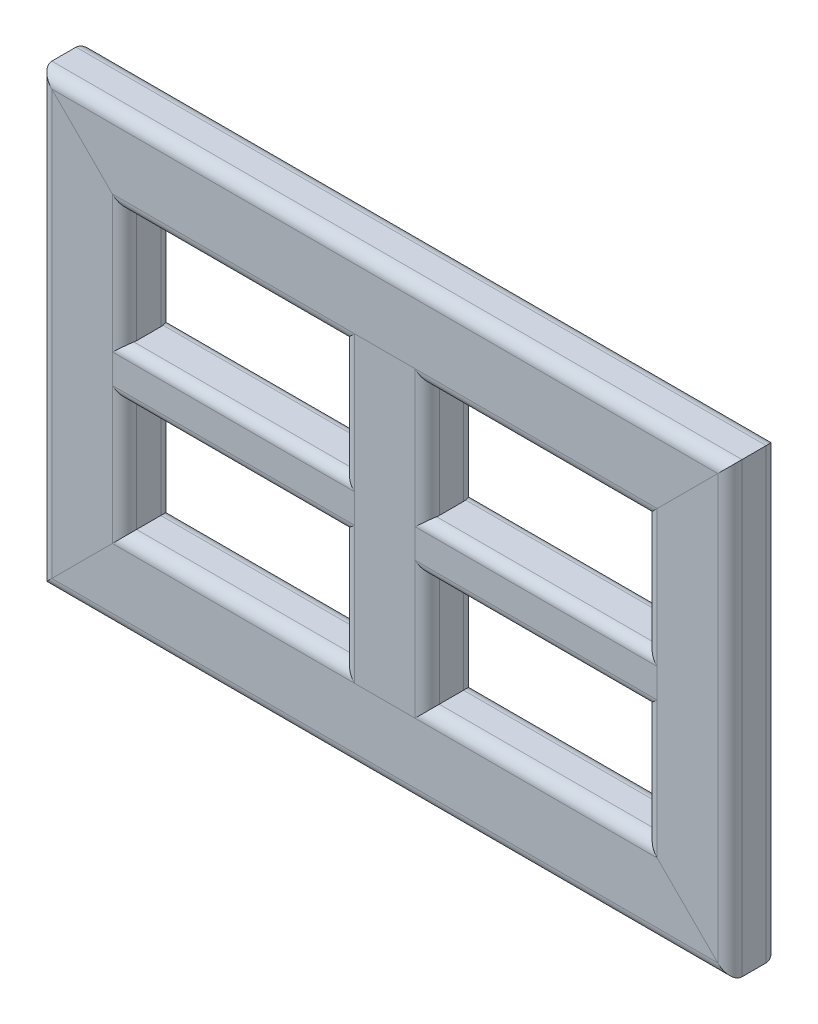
SolidWorks part; units mm, degrees
ref_plane "Płaszczyzna przednia" through (0, 0, 0) normal (0, 0, 1) x (1, 0, 0)
ref_plane "Płaszczyzna górna" through (0, 0, 0) normal (0, 1, 0) x (1, 0, 0)
ref_plane "Płaszczyzna prawa" through (0, 0, 0) normal (1, 0, 0) x (0, 0, -1)
sketch "Szkic1" plane through (0, 0, 0) normal (0, 0, 1) x (1, 0, 0)
  line L0 (0, 150) -> (0, -150)
  line L1 (250, -150) -> (-250, -150)
  line L2 (250, -150) -> (250, 150)
  line L3 (250, 150) -> (-250, 150)
  line L4 (-250, -150) -> (-250, 150)
  line L5 (250, -150) -> (-250, 150) construction
  line L6 (250, 150) -> (-250, -150) construction
  line L7 (-250, 0) -> (250, 0)
  point P0 (0, 0)
  dimension "D1" = 300
  dimension "D2" = 500
other "Rura prostokątna 70 X 40 X 5(1)"
ref_plane "Płaszczyzna1" through (-250, -150, 0) normal (0, 1, 0) x (0, 0, 1)
sketch "Sketch1" plane through (-250, -150, 0) normal (0, 1, 0) x (0, 0, 1)
  line L0 (-10, -30) -> (10, -30)
  line L1 (-15, -25) -> (-15, 25)
  line L2 (10, 30) -> (-10, 30)
  line L3 (15, 25) -> (15, -25)
  line L4 (-10, -35) -> (10, -35)
  line L5 (-20, -25) -> (-20, 25)
  line L6 (10, 35) -> (-10, 35)
  line L7 (20, 25) -> (20, -25)
  arc A0 (20, 25) -> (10, 35) centre (10, 25) ccw
  arc A1 (10, -35) -> (20, -25) centre (10, -25) ccw
  arc A2 (-20, -25) -> (-10, -35) centre (-10, -25) ccw
  arc A3 (-10, 35) -> (-20, 25) centre (-10, 25) ccw
  arc A4 (-10, 30) -> (-15, 25) centre (-10, 25) ccw
  arc A5 (15, 25) -> (10, 30) centre (10, 25) ccw
  arc A6 (10, -30) -> (15, -25) centre (10, -25) ccw
  arc A7 (-15, -25) -> (-10, -30) centre (-10, -25) ccw
  point P0 (0, 35)
  point P1 (20, 0)
  point P2 (0, -35)
  point P3 (-20, 0)
  point P4 (-20, 35)
  point P5 (20, 35)
  point P6 (20, -35)
  point P7 (-20, -35)
  point P8 (0, 0)
  point P33 (0, 0)
  dimension "D1" = 10
  dimension "Thickness" = 5
  dimension "V_leg" = 70
  dimension "H_leg" = 40
other "Rura kwadratowa 40 X 40 X 4(1)"
ref_plane "Płaszczyzna2" through (-250, 0, 0) normal (1, 0, 0) x (0, 1, 0)
sketch "Sketch11" plane through (-250, 0, 0) normal (1, 0, 0) x (0, 1, 0)
  line L0 (-12, -16) -> (12, -16)
  line L1 (-16, -12) -> (-16, 12)
  line L2 (12, 16) -> (-12, 16)
  line L3 (16, 12) -> (16, -12)
  line L4 (-12, -20) -> (12, -20)
  line L5 (-20, -12) -> (-20, 12)
  line L6 (12, 20) -> (-12, 20)
  line L7 (20, 12) -> (20, -12)
  arc A0 (20, 12) -> (12, 20) centre (12, 12) ccw
  arc A1 (12, -20) -> (20, -12) centre (12, -12) ccw
  arc A2 (-20, -12) -> (-12, -20) centre (-12, -12) ccw
  arc A3 (-12, 20) -> (-20, 12) centre (-12, 12) ccw
  arc A4 (-12, 16) -> (-16, 12) centre (-12, 12) ccw
  arc A5 (16, 12) -> (12, 16) centre (12, 12) ccw
  arc A6 (12, -16) -> (16, -12) centre (12, -12) ccw
  arc A7 (-16, -12) -> (-12, -16) centre (-12, -12) ccw
  point P0 (-20, 0)
  point P1 (20, 0)
  point P2 (0, 20)
  point P3 (0, -20)
  point P4 (0, 0)
  point P5 (-20, -20)
  point P6 (20, -20)
  point P7 (20, 20)
  point P8 (-20, 20)
  point P33 (0, 0)
  dimension "D1" = 8
  dimension "Thickness" = 4
  dimension "V_leg" = 40
other "Przytnij/Wydłuż1"
other "Przytnij/Wydłuż2"
